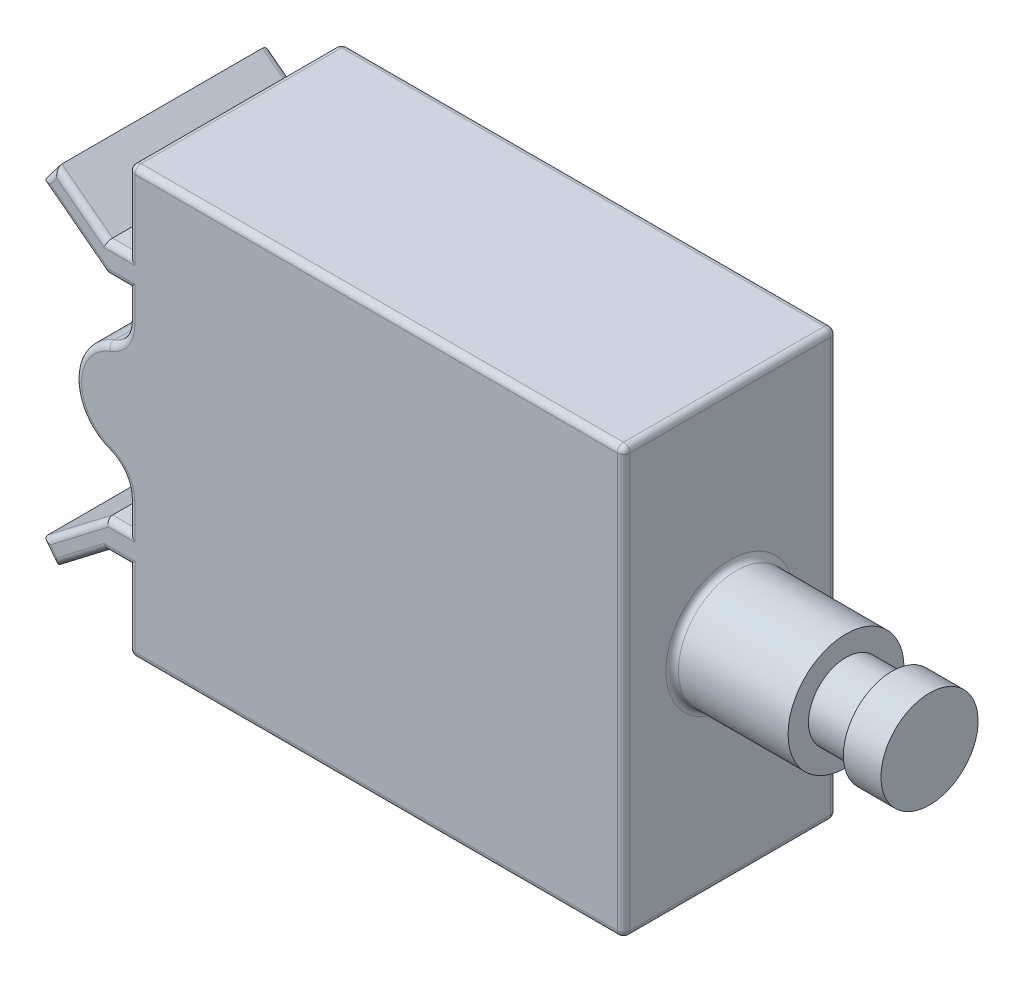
SolidWorks part; units mm, degrees
ref_plane "Front Plane" through (0, 0, 0) normal (0, 0, 1) x (1, 0, 0)
ref_plane "Top Plane" through (0, 0, 0) normal (0, 1, 0) x (1, 0, 0)
ref_plane "Right Plane" through (0, 0, 0) normal (1, 0, 0) x (0, 0, -1)
sketch "Sketch1" plane through (0, 0, 0) normal (0, 0, 1) x (1, 0, 0)
  line L0 (40.132, 17.272) -> (-4.318, 17.272) construction
  line L1 (0, 0) -> (40.132, 0)
  line L2 (0, 0) -> (0, 13.208)
  line L3 (0, 34.544) -> (40.132, 34.544)
  line L4 (40.132, 0) -> (40.132, 34.544)
  line L5 (0, 21.336) -> (0, 34.544)
  arc A0 (0, 21.336) -> (-4.318, 17.272) centre (-0.2465, 17.272) ccw
  arc A1 (0, 13.208) -> (-4.318, 17.272) centre (-0.2465, 17.272) cw
  dimension "D1" = 40.132
  dimension "D2" = 34.544
  dimension "D3" = 44.45
  dimension "D4" = 8.128
extrude "Boss-Extrude1" add sketch "Sketch1" along normal blind 17.272
fillet "Fillet1" radius 2.54 2 edges at (0, 13.208, 8.636) (0, 21.336, 8.636)
sketch "Sketch2" plane through (40.132, 0, 0) normal (1, 0, 0) x (0, 0, -1)
  line L0 (-8.636, 34.544) -> (-8.636, 0) construction
  line L1 (-17.272, 34.544) -> (0, 34.544) construction
  line L2 (-17.272, 0) -> (0, 0) construction
  line L3 (0, 17.272) -> (-17.272, 17.272) construction
  line L4 (0, 0) -> (0, 34.544) construction
  line L5 (-17.272, 0) -> (-17.272, 34.544) construction
  circle A0 centre (-8.636, 17.272) radius 4.699
  dimension "D1" = 9.398
extrude "Boss-Extrude2" add sketch "Sketch2" along normal blind 9.398
sketch "Sketch3" plane through (49.53, 0, 0) normal (1, 0, 0) x (0, 0, -1)
  circle A0 centre (-8.636, 17.272) radius 3.048
  circle A1 centre (-8.636, 17.272) radius 4.699 construction
  dimension "D1" = 6.096
extrude "Boss-Extrude3" add sketch "Sketch3" along normal blind 3.81
sketch "Sketch4" plane through (53.34, 0, 0) normal (1, 0, 0) x (0, 0, -1)
  circle A0 centre (-8.724, 17.3613) radius 3.937
  dimension "D1" = 7.874
extrude "Boss-Extrude4" add sketch "Sketch4" along normal blind 3.048
sketch "Sketch5" plane through (0, 0, 17.272) normal (0, 0, 1) x (1, 0, 0)
  line L0 (40.132, 17.272) -> (-4.318, 17.272) construction
  line L1 (40.132, 12.573) -> (40.132, 21.971) construction
  line L2 (0, 25.825) -> (-1.806, 25.825)
  line L3 (0, 34.544) -> (0, 23.4729) construction
  line L4 (-1.806, 25.825) -> (-7.0425, 29.8397)
  line L5 (-7.0425, 29.8397) -> (-5.916, 31.3092)
  line L6 (-5.916, 31.3092) -> (-1.806, 28.1582)
  line L7 (-1.806, 28.1582) -> (0, 28.1582)
  line L8 (0, 28.1582) -> (0, 25.825)
  line L9 (0, 6.3858) -> (0, 8.719)
  line L10 (-1.806, 6.3858) -> (0, 6.3858)
  line L11 (-5.916, 3.2348) -> (-1.806, 6.3858)
  line L12 (-7.0425, 4.7043) -> (-5.916, 3.2348)
  line L13 (-1.806, 8.719) -> (-7.0425, 4.7043)
  line L14 (0, 8.719) -> (-1.806, 8.719)
  arc A0 (-1.6589, 21.0907) -> (-1.6589, 13.4533) centre (-0.2465, 17.272) ccw construction
extrude "Boss-Extrude5" add sketch "Sketch5" against normal up to surface (17.272 mm away)
fillet "Fillet2" radius 0.508 45 edges at (0, 0, 8.636) (0, 34.544, 8.636) (40.132, 17.272, 13.335) (40.132, 0, 8.636) (40.132, 34.544, 8.636) (-0.903, 8.719, 0) (-0.903, 8.719, 17.272) (-4.4243, 6.7116, 0) (-4.4243, 6.7116, 17.272) (-6.4792, 3.9696, 0) (-6.4792, 3.9696, 17.272) (-3.861, 4.8103, 0) (-3.861, 4.8103, 17.272) (-0.903, 6.3858, 0) (-0.903, 6.3858, 17.272) (0, 3.1929, 17.272) (0, 3.1929, 0) (20.066, 0, 0) (20.066, 0, 17.272) (40.132, 17.272, 0) (40.132, 17.272, 17.272) (20.066, 34.544, 0) (20.066, 34.544, 17.272) (0, 31.3511, 0) (0, 31.3511, 17.272) (-0.903, 28.1582, 0) (-0.903, 28.1582, 17.272) (-3.861, 29.7337, 0) (-3.861, 29.7337, 17.272) (-6.4792, 30.5744, 0) (-6.4792, 30.5744, 17.272) (-4.4243, 27.8324, 0) (-4.4243, 27.8324, 17.272) (-0.903, 25.825, 0) (-0.903, 25.825, 17.272) (0, 24.649, 17.272) (0, 24.649, 0) (-0.4556, 22.0215, 17.272) (-0.4556, 22.0215, 0) (-4.318, 17.272, 0) (-4.318, 17.272, 17.272) (-0.4556, 12.5225, 17.272) (-0.4556, 12.5225, 0) (0, 9.895, 0) (0, 9.895, 17.272)
